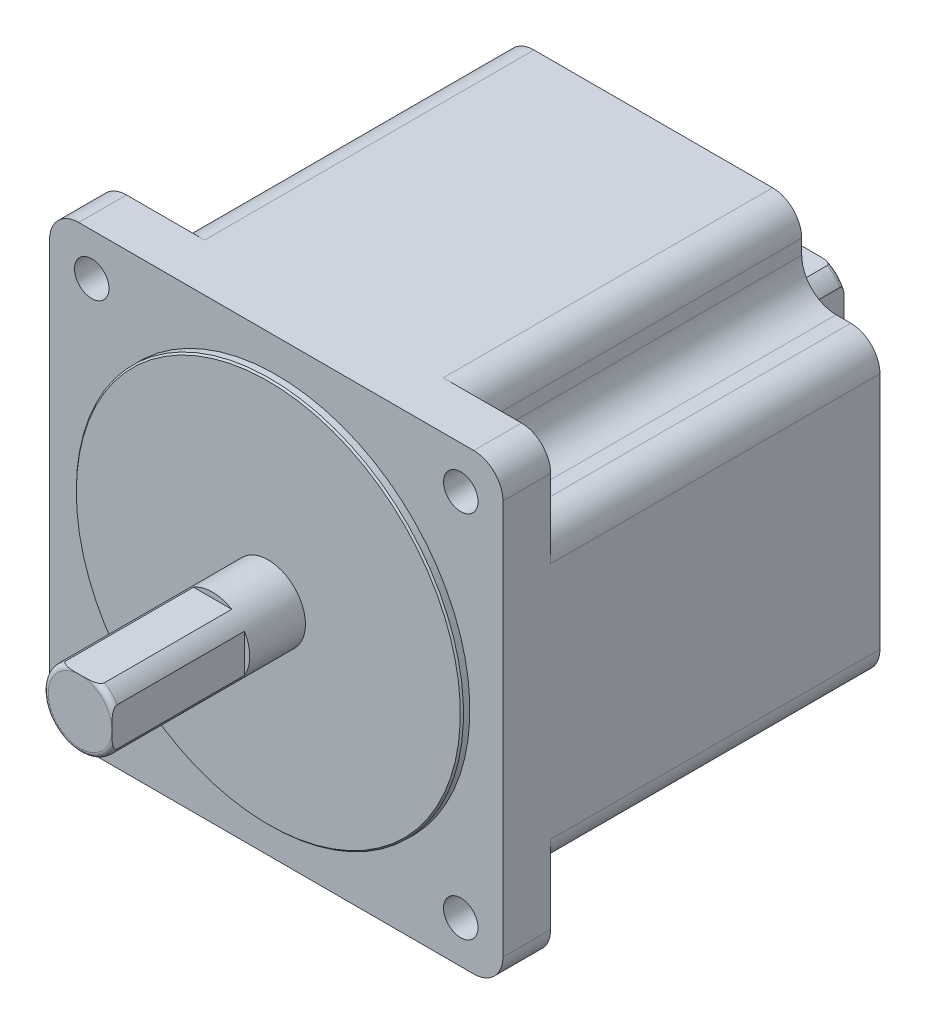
SolidWorks part; units mm, degrees
ref_plane "正面" through (0, 0, 0) normal (0, 0, 1) x (1, 0, 0)
ref_plane "平面" through (0, 0, 0) normal (0, 1, 0) x (1, 0, 0)
ref_plane "右側面" through (0, 0, 0) normal (1, 0, 0) x (0, 0, -1)
sketch "ｽｹｯﾁ1" plane through (0, 0, 0) normal (0, 0, 1) x (1, 0, 0)
  circle A0 centre (0, 0) radius 7
  dimension "D1" = 14
extrude "押し出し1" add sketch "ｽｹｯﾁ1" along normal blind 35.5
sketch "ｽｹｯﾁ2" plane through (0, 0, 0) normal (0, 0, -1) x (-1, 0, 0)
  circle A0 centre (0, 0) radius 36.5125
  dimension "D1" = 73.025
extrude "押し出し2" add sketch "ｽｹｯﾁ2" along normal blind 1.5
sketch "ｽｹｯﾁ3" plane through (0, 0, -1.5) normal (0, 0, -1) x (-1, 0, 0)
  line L1 (-42.75, 42.75) -> (42.75, 42.75)
  line L2 (-42.75, 42.75) -> (-42.75, -42.75)
  line L3 (-42.75, -42.75) -> (42.75, -42.75)
  line L4 (42.75, 42.75) -> (42.75, -42.75)
  line L5 (-42.75, 42.75) -> (42.75, -42.75) construction
  line L6 (-42.75, -42.75) -> (42.75, 42.75) construction
  line L7 (34.8, 34.8) -> (-34.8, 34.8) construction
  line L8 (34.8, 34.8) -> (34.8, -34.8) construction
  line L9 (34.8, -34.8) -> (-34.8, -34.8) construction
  line L10 (-34.8, 34.8) -> (-34.8, -34.8) construction
  line L11 (34.8, 34.8) -> (-34.8, -34.8) construction
  line L12 (34.8, -34.8) -> (-34.8, 34.8) construction
  circle A0 centre (34.8, 34.8) radius 3.25
  circle A1 centre (-34.8, 34.8) radius 3.25
  circle A2 centre (34.8, -34.8) radius 3.25
  circle A3 centre (-34.8, -34.8) radius 3.25
  point P0 (0, 0)
  point P6 (0, 0)
  dimension "D3" = 69.6
  dimension "D4" = 69.6
  dimension "D6" = 6.5
  dimension "D1" = 85.5
  dimension "D2" = 85.5
extrude "押し出し3" add sketch "ｽｹｯﾁ3" along normal blind 9
fillet "Fillet1" radius 5.5 4 edges at (42.75, -42.75, -6) (-42.75, -42.75, -6) (-42.75, 42.75, -6) (42.75, 42.75, -6)
sketch "ｽｹｯﾁ4" plane through (0, 0, -10.5) normal (0, 0, -1) x (-1, 0, 0)
  line L0 (28, 28) -> (42.75, 28)
  line L1 (-28, 42.75) -> (28, 42.75)
  line L2 (-28, 42.75) -> (-28, 28)
  line L3 (-28, -42.75) -> (28, -42.75)
  line L4 (28, 42.75) -> (28, 28)
  line L5 (-28, 42.75) -> (28, -42.75) construction
  line L6 (-28, -42.75) -> (28, 42.75) construction
  line L7 (-42.75, 28) -> (-28, 28)
  line L8 (-42.75, 28) -> (-42.75, -28)
  line L9 (-42.75, -28) -> (-28, -28)
  line L10 (42.75, 28) -> (42.75, -28)
  line L11 (-42.75, 28) -> (42.75, -28) construction
  line L12 (-42.75, -28) -> (42.75, 28) construction
  line L13 (-28, -28) -> (-28, -42.75)
  line L14 (28, -28) -> (42.75, -28)
  line L15 (28, -28) -> (28, -42.75)
  point P0 (0, 0)
  point P6 (0, 0)
  dimension "D1" = 56
  dimension "D2" = 85.5
  dimension "D3" = 85.5
  dimension "D4" = 56
extrude "押し出し4" add sketch "ｽｹｯﾁ4" along normal blind 62.1
fillet "Fillet2" radius 6.5 4 edges at (28, -28, -41.55) (-28, -28, -41.55) (-28, 28, -41.55) (28, 28, -41.55)
fillet "Fillet3" radius 5.5 8 edges
sketch "Sketch1" plane through (0, -42.75, 0) normal (0, -1, 0) x (1, 0, 0)
  line L0 (22.5, -72.6) -> (-22.5, -72.6) construction
  line L1 (-13.25, -72.6) -> (13.25, -72.6)
  line L2 (-13.25, -72.6) -> (-13.25, -51.6)
  line L3 (-13.25, -51.6) -> (13.25, -51.6)
  line L4 (13.25, -72.6) -> (13.25, -51.6)
  dimension "D1" = 21
  dimension "D2" = 26.5
  dimension "D3" = 13.25
extrude "Extrude1" add sketch "Sketch1" along normal blind 12
sketch "Sketch5" plane through (13.25, 0, 0) normal (1, 0, 0) x (0, 0, -1)
  line L0 (72.6, -47.75) -> (64, -54.75)
  line L3 (72.6, -54.75) -> (72.6, -42.75) construction
  line L4 (72.6, -54.75) -> (51.6, -54.75) construction
  line L6 (64, -54.75) -> (72.6, -54.75)
  line L8 (72.6, -54.75) -> (72.6, -47.75)
  dimension "D1" = 7
  dimension "D2" = 8.6
extrude "Extrude4" cut sketch "Sketch5" against normal through all and the other way through all
sketch "Sketch6" plane through (0, 0, -51.6) normal (0, 0, 1) x (1, 0, 0)
  line L0 (-13.25, -49.75) -> (-13.25, -54.75)
  line L2 (-13.25, -49.75) -> (-13.25, -54.75)
  line L3 (-13.25, -54.75) -> (-7.5, -54.75)
  line L4 (13.25, -54.75) -> (-13.25, -54.75) construction
  line L5 (-7.5, -54.75) -> (-13.25, -49.75)
  line L6 (13.25, -49.75) -> (13.25, -54.75)
  line L7 (13.25, -54.75) -> (13.25, -42.75) construction
  line L8 (13.25, -54.75) -> (7.5, -54.75)
  line L9 (7.5, -54.75) -> (13.25, -49.75)
  dimension "D1" = 5
  dimension "D2" = 7.5
  dimension "D3" = 15
  dimension "D4" = 5
extrude "Extrude5" cut sketch "Sketch6" against normal through all contours L5 M3 M2 | L9 M3 M4
fillet "Fillet4" radius 1 1 edges at (7, 0, 35.5)
sketch "Sketch2" plane through (0, 0, 35.5) normal (0, 0, 1) x (1, 0, 0)
  line L1 (-7, 8) -> (7, 8)
  line L2 (-7, 8) -> (-7, 6)
  line L3 (-7, 6) -> (7, 6)
  line L4 (7, 8) -> (7, 6)
  line L5 (8, -8) -> (6, -8)
  line L6 (8, -8) -> (8, 6)
  line L7 (8, 6) -> (6, 6)
  line L8 (6, -8) -> (6, 6)
  circle A0 centre (0, 0) radius 7 construction
  dimension "D1" = 6
  dimension "D2" = 14
  dimension "D3" = 2
  dimension "D4" = 7
  dimension "D5" = 6
  dimension "D6" = 2
  dimension "D7" = 14
extrude "Extrude2" cut sketch "Sketch2" against normal blind 25 contours L4 L1 L2 L3 | L6 L7 L8 L5
chamfer "Chamfer2" distance 0.3 angle 45 1 edges at (-36.5125, 0, 0)
sketch "Sketch3" plane through (0, 0, -1.5) normal (0, 0, 1) x (1, 0, 0)
  circle A0 centre (0, 0) radius 18
  circle A1 centre (0, 0) radius 24.35
  dimension "D1" = 48.7
  dimension "D2" = 36
extrude "Extrude3" cut sketch "Sketch3" against normal blind 0.2
chamfer "Chamfer3" distance 0.2 distance2 0.4 1 edges at (24.35, 0, -1.7)
sketch "Sketch7" plane through (0, 0, -72.6) normal (0, 0, -1) x (-1, 0, 0)
  circle A0 centre (0, 0) radius 7
  dimension "D1" = 14
extrude "Extrude6" add sketch "Sketch7" along normal blind 30
fillet "Fillet5" radius 0.8 1 edges at (-7, 0, -102.6)
sketch "Sketch8" plane through (0, 0, -102.6) normal (0, 0, -1) x (-1, 0, 0)
  line L1 (-7, 8) -> (7, 8)
  line L2 (-7, 8) -> (-7, 6)
  line L3 (-7, 6) -> (7, 6)
  line L4 (7, 8) -> (7, 6)
  line L5 (-7, 8) -> (7, 6) construction
  line L6 (-7, 6) -> (7, 8) construction
  line L7 (-6, 7) -> (-8, 7)
  line L8 (-6, 7) -> (-6, -7)
  line L9 (-6, -7) -> (-8, -7)
  line L10 (-8, 7) -> (-8, -7)
  line L11 (-6, 7) -> (-8, -7) construction
  line L12 (-6, -7) -> (-8, 7) construction
  point P0 (0, 7)
  point P6 (-7, 0)
  dimension "D1" = 6
  dimension "D2" = 7
  dimension "D3" = 14
  dimension "D4" = 2
  dimension "D5" = 6
  dimension "D6" = 7
  dimension "D7" = 14
  dimension "D8" = 2
extrude "Extrude7" cut sketch "Sketch8" against normal blind 25 contours L8 L7 L4 L1 L2 L3 M1 | L3 M1 | L7 L10 L9 L8 L3 L2 M1 | L8 M1
